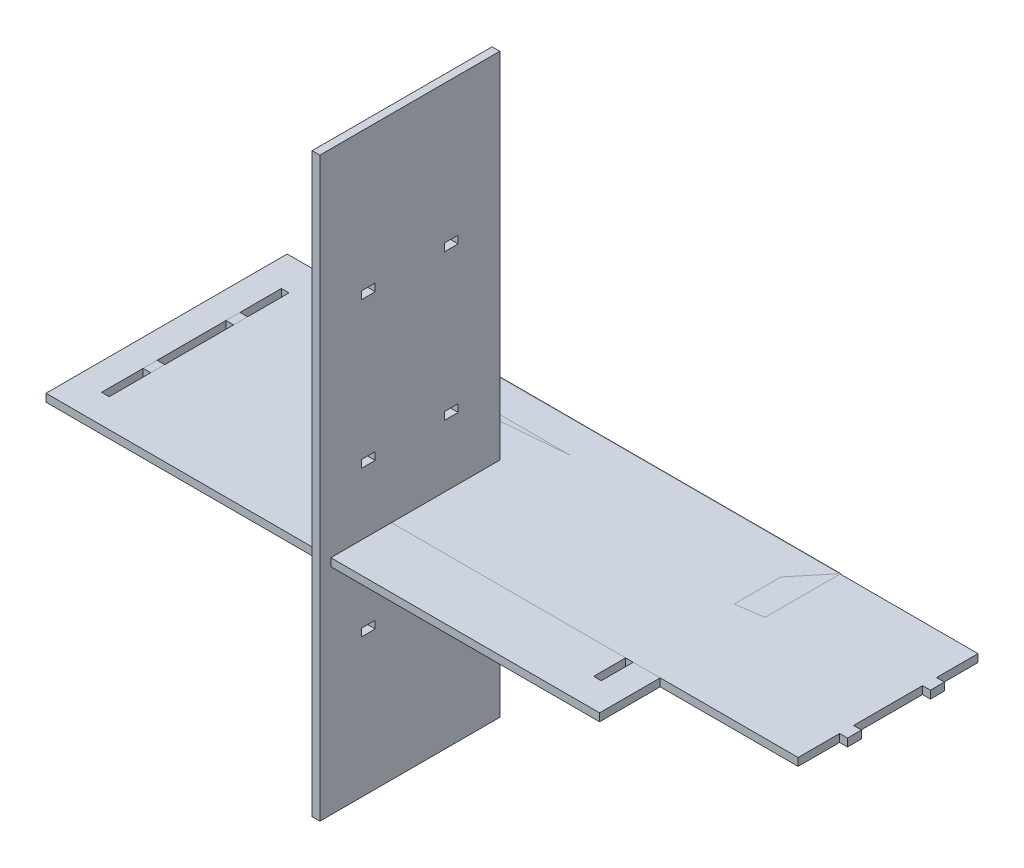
SolidWorks part; units mm, degrees
ref_plane "Piano frontale" through (0, 0, 0) normal (0, 0, 1) x (1, 0, 0)
ref_plane "Piano superiore" through (0, 0, 0) normal (0, 1, 0) x (1, 0, 0)
ref_plane "Piano destro" through (0, 0, 0) normal (1, 0, 0) x (0, 0, -1)
sketch "Schizzo1" plane through (0, 0, 0) normal (0, 1, 0) x (1, 0, 0)
  line L0 (-42.3626, 13.299) -> (-42.3626, -7.8971)
  line L1 (-42.3626, -7.8971) -> (-34.2026, -7.8971)
  line L2 (-34.2026, -7.8971) -> (-34.2026, -2.1143)
  line L3 (-34.2026, -2.1143) -> (-28.5026, -2.1143)
  line L4 (-28.5026, -2.1143) -> (-28.5026, 7.9857)
  line L5 (-28.5026, 7.9857) -> (-34.2026, 7.9857)
  line L6 (-34.2026, 7.9857) -> (-34.2026, 13.299)
  line L7 (-34.2026, 13.299) -> (-42.3626, 13.299)
  line L8 (-55.577, 13.3989) -> (-43.3369, 13.3989)
  line L9 (-55.577, -7.8011) -> (-43.3369, -7.8011)
  line L10 (-55.577, -7.8011) -> (-55.577, -2.0183)
  line L11 (-55.577, -2.0183) -> (-50.077, -2.0183)
  line L12 (-50.077, -2.0183) -> (-50.077, 7.7817)
  line L13 (-50.077, 7.7817) -> (-55.577, 7.7817)
  line L14 (-55.577, 7.7817) -> (-55.577, 13.3989)
  line L15 (-43.3369, -7.8011) -> (-43.3369, 13.3989)
  line L16 (-215.4988, 26.8713) -> (-215.4988, 5.1281)
  line L17 (-215.4988, 5.1281) -> (-197.8446, 5.1469)
  line L18 (-209.7983, 10.5043) -> (-209.7983, 20.4043)
  line L19 (-209.7983, 20.4043) -> (-204.2983, 20.4043)
  line L20 (-204.2983, 10.5043) -> (-204.2983, 20.4043)
  line L21 (-215.4988, 26.8713) -> (-197.8446, 26.8713)
  line L22 (-197.8446, 26.8713) -> (-197.8446, 5.1469)
  line L29 (-209.7983, 10.5043) -> (-204.2983, 10.5043)
sketch "Schizzo2" plane through (0, 0, 0) normal (0, 1, 0) x (1, 0, 0)
  line L0 (22.8338, 13.8944) -> (22.8338, -7.0859)
  line L1 (22.8338, -7.0859) -> (39.8687, -7.0678)
  line L2 (28.3344, -1.8019) -> (28.3344, 8.0981)
  line L3 (28.3344, 8.0981) -> (33.8344, 8.0981)
  line L4 (33.8344, -1.8019) -> (33.8344, 8.0981)
  line L5 (22.8338, 13.8944) -> (39.8687, 13.8944)
  line L6 (39.8687, 13.8944) -> (39.8687, -7.0678)
  line L7 (28.3344, -1.8019) -> (33.8344, -1.8019)
  line L8 (8.3997, 13.5093) -> (8.3997, -7.6868)
  line L9 (8.3997, -7.6868) -> (16.5597, -7.6868)
  line L10 (16.5597, -7.6868) -> (16.5597, -1.904)
  line L11 (16.5597, -1.904) -> (22.2597, -1.904)
  line L12 (22.2597, -1.904) -> (22.2597, 8.196)
  line L13 (22.2597, 8.196) -> (16.5597, 8.196)
  line L14 (16.5597, 8.196) -> (16.5597, 13.5093)
  line L15 (16.5597, 13.5093) -> (8.3997, 13.5093)
sketch "Schizzo3" plane through (0, 0, 0) normal (0, 1, 0) x (1, 0, 0)
  line L1 (-22.952, 18.4276) -> (-6.4981, 18.4276)
  line L2 (-22.952, 18.4276) -> (-22.952, -34.1226)
  line L3 (-22.952, -34.1226) -> (-6.4981, -34.1226)
  line L4 (-6.4981, 18.4276) -> (-6.4981, -34.1226)
sketch "Schizzo4" plane through (0, 0, 0) normal (1, 0, 0) x (0, 0, -1)
  line L0 (-3.5798, 161.4632) -> (6.3202, 161.4632)
  line L1 (-93.5798, 261.4632) -> (36.4202, 261.4632)
  line L2 (-93.5798, 261.4632) -> (-93.5798, -155.3708)
  line L4 (36.4202, 261.4632) -> (36.4202, -155.3708)
  line L5 (-63.4798, 161.4632) -> (-53.5798, 161.4632)
  line L6 (-63.4798, 161.4632) -> (-63.4798, 155.9632)
  line L7 (-63.4798, 155.9632) -> (-53.5798, 155.9632)
  line L8 (-53.5798, 161.4632) -> (-53.5798, 155.9632)
  line L9 (-3.5798, 161.4632) -> (-3.5798, 155.9632)
  line L10 (-3.5798, 155.9632) -> (6.3202, 155.9632)
  line L11 (6.3202, 161.4632) -> (6.3202, 155.9632)
  line L12 (-3.5798, 55.9632) -> (6.3202, 55.9632)
  line L13 (-63.4798, 55.9632) -> (-53.5798, 55.9632)
  line L14 (-63.4798, 55.9632) -> (-63.4798, 50.4632)
  line L15 (-63.4798, 50.4632) -> (-53.5798, 50.4632)
  line L16 (-53.5798, 55.9632) -> (-53.5798, 50.4632)
  line L17 (-3.5798, 55.9632) -> (-3.5798, 50.4632)
  line L18 (-3.5798, 50.4632) -> (6.3202, 50.4632)
  line L19 (6.3202, 55.9632) -> (6.3202, 50.4632)
  line L20 (-3.5798, -49.5368) -> (6.3202, -49.5368)
  line L21 (-63.4798, -49.5368) -> (-53.5798, -49.5368)
  line L22 (-63.4798, -49.5368) -> (-63.4798, -55.0368)
  line L23 (-63.4798, -55.0368) -> (-53.5798, -55.0368)
  line L24 (-53.5798, -49.5368) -> (-53.5798, -55.0368)
  line L25 (-3.5798, -49.5368) -> (-3.5798, -55.0368)
  line L26 (-3.5798, -55.0368) -> (6.3202, -55.0368)
  line L27 (6.3202, -49.5368) -> (6.3202, -55.0368)
  line L28 (-93.5798, -155.3708) -> (36.4202, -155.3708)
  point P12 (-58.5298, 161.4632)
extrude "Estrusione-Estrusione1" add sketch "Schizzo4" along normal blind 5.6
sketch "Schizzo5" plane through (0, 0, 0) normal (0, 1, 0) x (1, 0, 0)
  line L0 (-50.5576, -11.8814) -> (-56.2576, -11.8814)
  line L1 (-50.5576, 88.1186) -> (299.4424, 88.1186)
  line L2 (-50.5576, 88.1186) -> (-50.5576, 58.1186)
  line L3 (-50.5576, -41.8814) -> (299.4424, -41.8814)
  line L4 (299.4424, -11.8814) -> (299.4424, -41.8814)
  line L5 (-56.2576, -11.8814) -> (-56.2576, -1.7814)
  line L6 (-56.2576, -1.7814) -> (-50.5576, -1.7814)
  line L7 (-50.5576, -11.8814) -> (-50.5576, -41.8814)
  line L8 (-50.5576, 58.1186) -> (-56.2576, 58.1186)
  line L9 (-56.2576, 58.1186) -> (-56.2576, 48.0186)
  line L10 (-56.2576, 48.0186) -> (-50.5576, 48.0186)
  line L11 (-50.5576, 48.0186) -> (-50.5576, -1.7814)
  line L13 (299.4424, 88.1186) -> (299.4424, 58.1186)
  line L16 (305.1424, 48.0186) -> (299.4424, 48.0186)
  line L17 (305.1424, 58.1186) -> (305.1424, 48.0186)
  line L18 (299.4424, 58.1186) -> (305.1424, 58.1186)
  line L19 (305.1424, -1.7814) -> (299.4424, -1.7814)
  line L20 (305.1424, -11.8814) -> (305.1424, -1.7814)
  line L21 (299.4424, -11.8814) -> (305.1424, -11.8814)
  line L22 (299.4424, 48.0186) -> (299.4424, -1.7814)
  point P12 (-56.2576, 53.0686)
  point P13 (-56.2576, -6.8314)
extrude "Estrusione-Estrusione2" add sketch "Schizzo5" along normal blind 5.6 separate body
sketch "Schizzo6" plane through (0, 0, 0) normal (0, 1, 0) x (1, 0, 0)
  line L0 (-175, -35) -> (-180.7, -35)
  line L1 (-175, 65) -> (-55, 65)
  line L2 (-175, 65) -> (-175, 35)
  line L3 (-175, -65) -> (-55, -65)
  line L5 (-180.7, -35) -> (-180.7, -24.9)
  line L6 (-180.7, -24.9) -> (-175, -24.9)
  line L7 (-175, -35) -> (-175, -65)
  line L8 (-175, 35) -> (-180.7, 35)
  line L9 (-180.7, 35) -> (-180.7, 24.9)
  line L10 (-180.7, 24.9) -> (-175, 24.9)
  line L11 (-175, 24.9) -> (-175, -24.9)
  line L20 (-55, 65) -> (-55, -65)
  point P12 (-180.7, 29.95)
  point P13 (-180.7, -29.95)
  dimension "D1" = 120
  dimension "D2" = 5.7
  dimension "D3" = 5.7
  dimension "D4" = 10.1
  dimension "D5" = 10.1
  dimension "D6" = 5.7
  dimension "D7" = 59.9
  dimension "D8" = 30
  dimension "D9" = 30
extrude "Estrusione-Estrusione3" add sketch "Schizzo6" along normal blind 5.6 separate body
sketch "Schizzo8" plane through (0, 0, 0) normal (0, 1, 0) x (1, 0, 0)
  line L0 (-180.7, -65) -> (-175.2, -65)
  line L1 (-175.2, 64.9) -> (174.8, 64.9)
  line L2 (-175.2, 64.9) -> (-175.2, -65)
  line L3 (-175.2, -65) -> (174.8, -65)
  line L5 (180.3, 64.9) -> (174.8, 64.9)
  line L6 (180.3, -65) -> (180.3, 64.9)
  line L7 (174.8, 64.9) -> (174.8, -65)
  line L8 (180.3, -65) -> (174.8, -65)
  line L9 (-200.2, 88.585) -> (199.8, 88.585)
  line L10 (-200.2, 88.585) -> (-200.2, -85.6857)
  line L11 (-180.7, -65) -> (-180.7, 64.9)
  line L12 (-200.2, -85.6857) -> (199.8, -85.6857)
  line L13 (199.8, 88.585) -> (199.8, -85.6857)
  line L20 (-180.7, 64.9) -> (-175.2, 64.9)
  point P11 (180.3, -0.05)
  point P12 (-0.2, 64.9)
extrude "Estrusione-Estrusione4" add sketch "Schizzo8" along normal blind 5.6 separate body contours L13 L9 L10 L12 L11 L20 L1 L5 L6 L8 L3 L0 | L7 L1 L2 L3
equation "\"k\"= 0.1mm'kerf"
equation "\"m\"= 5.6mm'material thickness"
equation "\"tf\"= \"m\" - \"k\"'female thickness"
equation "\"tm\"= \"m\" + \"k\"'male thickness"
equation "\"j\"= 10mm'joint"
equation "\"jf\"= \"j\" - \"k\"'female joint"
equation "\"jm\"= \"j\" + \"k\"'male joint"
equation "\"D1@Schizzo1\"=\"jm\""
equation "\"D2@Schizzo1\"=\"tm\""
equation "\"D3@Schizzo1\"=\"tm\""
equation "\"D9@Schizzo1\"=\"tf\""
equation "\"D10@Schizzo1\"=\"tf\""
equation "\"D11@Schizzo1\"=\"jf\""
equation "\"D1@Schizzo2\"=\"tf\""
equation "\"D6@Schizzo2\"=\"jf\""
equation "\"D3@Schizzo2\"=\"tm\""
equation "\"D4@Schizzo2\"=\"tm\""
equation "\"D2@Schizzo2\"=\"jm\""
equation "\"D4@Schizzo4\"=\"jf\""
equation "\"D5@Schizzo4\"=\"tf\""
equation "\"D3@Schizzo5\"=\"tm\""
equation "\"D4@Schizzo5\"=\"tm\""
equation "\"D5@Schizzo5\"=\"jm\""
equation "\"D2@Schizzo5\"=\"jm\""
equation "\"D6@Schizzo5\"=\"tm\""
equation "\"p\"= 130'part"
equation "\"pf\"= \"p\" - \"k\"'female part"
equation "\"D1@Schizzo8\"=\"pf\""
equation "\"D3@Schizzo8\"=\"tf\""
